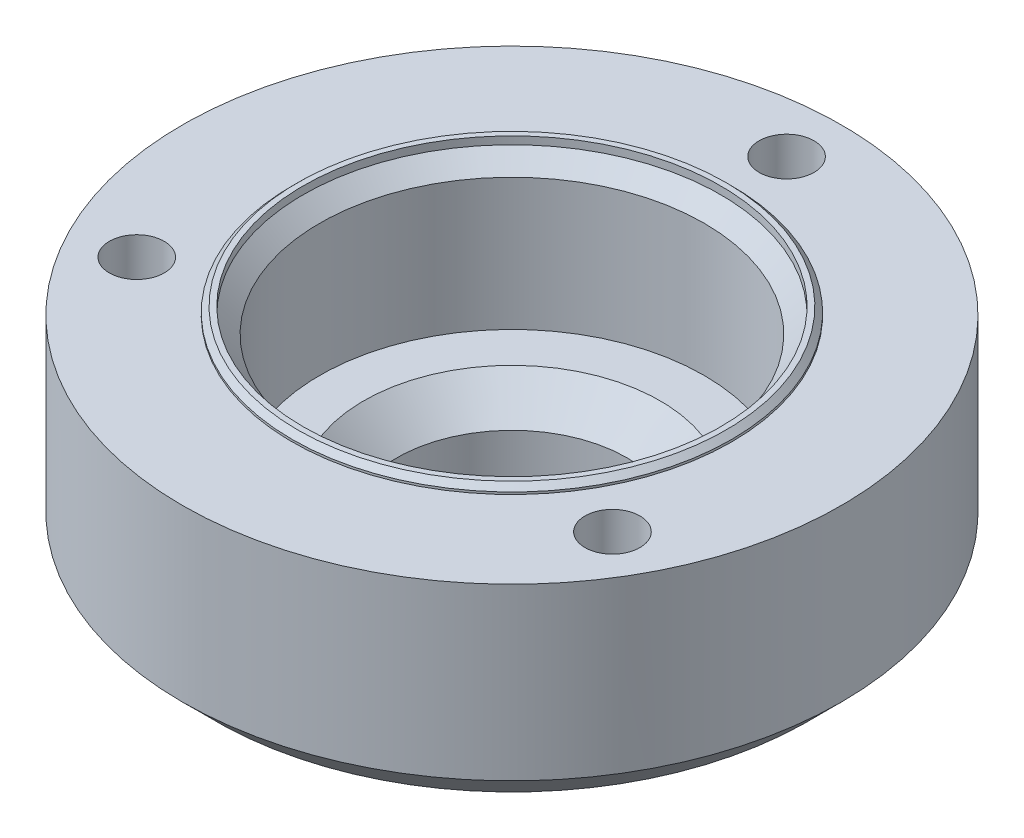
SolidWorks part; units mm, degrees
ref_plane "Face" through (0, 0, 0) normal (0, 0, 1) x (1, 0, 0)
ref_plane "Dessus" through (0, 0, 0) normal (0, 1, 0) x (1, 0, 0)
ref_plane "Droite" through (0, 0, 0) normal (1, 0, 0) x (0, 0, -1)
sketch "Esquisse1" plane through (0, 0, 0) normal (0, 0, 1) x (1, 0, 0)
  line L0 (0, 0) -> (0, 74.2586) construction
  line L1 (17.5, 54.8796) -> (17.5, 39.8796)
  line L2 (17.5, 39.8796) -> (10.5, 39.8796)
  line L3 (10.5, 39.8796) -> (10.5, 24.8796)
  dimension "D1" = 15
  dimension "D2" = 21
  dimension "D3" = 35
  dimension "D4" = 15
revolve "Révol.-Mince1" add sketch "Esquisse1" angle 360 about L0
sketch "Esquisse2" plane through (0, 54.8796, 0) normal (0, 1, 0) x (1, 0, 0)
  circle A0 centre (0, 0) radius 30
  circle A1 centre (0, 0) radius 17.5
  dimension "D1" = 60
extrude "Extrusion1" add sketch "Esquisse2" against normal up to surface (16.5 mm away) from offset 1.5
sketch "Esquisse3" plane through (0, 53.3796, 0) normal (0, 1, 0) x (1, 0, 0)
  line L0 (0, 0) -> (0, 25) construction
  line L1 (0, 0) -> (21.6506, -12.5) construction
  line L2 (0, 0) -> (-21.6506, -12.5) construction
  circle A0 centre (0, 0) radius 25 construction
  dimension "D3" = 50
  dimension "D1" = 120
  dimension "D2" = 120
hole_wizard "Trou taraudé M6x1.01" positions "Esquisse3D1" profile "Esquisse4" tap size "M6x1.0" standard "Ansi Métrique"
sketch3d "Esquisse3D1"
  point P0 (-21.6506, 53.3796, 12.5)
  point P3 (0, 53.3796, -25)
  point P6 (21.6506, 53.3796, 12.5)
sketch "Esquisse4" plane through (-21.6506, 53.3796, 12.5) normal (1, 0, 0) x (0, 0, 1)
  line L0 (0, 0) -> (0, 15.5022)
  line L1 (0, 15.5022) -> (2.5, 14)
  line L2 (2.5, 14) -> (2.5, 0)
  line L5 (2.5, 0) -> (0, 0)
  line L10 (0, 15.5022) -> (-2.5, 14) construction
  line L11 (0, -6.35) -> (0, 107.95) construction
  dimension "Diamètre du trou pour taraudage" = 5
  dimension "Profondeur du trou pour taraudage" = 14
  dimension "Angle de pointe" = 118
sketch "Esquisse5" plane through (0, 24.8796, 0) normal (0, -1, 0) x (1, 0, 0)
  circle A0 centre (0, 0) radius 12.75
  dimension "D1" = 25.5
extrude "Extrusion2" cut sketch "Esquisse5" against normal up to surface (12 mm away) flip side to cut
chamfer "Chanfrein1" distance 1 angle 45 2 edges at (0, 54.8796, -20.5) (0, 24.8796, -12.75)
sketch "Esquisse6" plane through (0, 53.3796, 0) normal (0, 1, 0) x (1, 0, 0)
  line L1 (-39.2588, 25.9409) -> (30.11, 25.9409)
  line L2 (-39.2588, 25.9409) -> (-39.2588, -23.2774)
  line L3 (-39.2588, -23.2774) -> (30.11, -23.2774)
  line L4 (30.11, 25.9409) -> (30.11, -23.2774)
extrude "Extrusion3" cut sketch "Esquisse6" along normal blind 8.4
chamfer "Chanfrein4" distance 1.5 angle 45 1 edges at (0, 53.3796, 17.5)
sketch "Esquisse7" plane through (0, 36.8796, 0) normal (0, -1, 0) x (1, 0, 0)
  circle A0 centre (0, 0) radius 20
  circle A1 centre (0, 0) radius 11.9927
  dimension "D1" = 40
extrude "Extrusion4" add sketch "Esquisse7" along normal blind 6
sketch "Esquisse10" plane through (0, 36.8796, 0) normal (0, -1, 0) x (1, 0, 0)
  circle A0 centre (0, 0) radius 30
  circle A1 centre (0, 0) radius 17.6221
extrude "Extrusion7" add sketch "Esquisse10" along normal blind 2
chamfer "Chanfrein5" distance 3 angle 45 3 edges at (0, 30.8796, -20) (0, 34.8796, -30) (0, 39.8796, -10.5)
sketch "Esquisse9" plane through (0, 24.8796, 0) normal (0, -1, 0) x (1, 0, 0)
  circle A0 centre (0, 0) radius 11.5
  dimension "D1" = 23
sketch "Esquisse11" plane through (0, 34.8796, 0) normal (0, -1, 0) x (1, 0, 0)
  circle A0 centre (0, 0) radius 12.75 construction
  circle A1 centre (0, 0) radius 12.75
  circle A2 centre (0, 0) radius 20 construction
  circle A3 centre (0, 0) radius 20
extrude "Extrusion8" cut sketch "Esquisse11" along normal blind 10
sketch "Esquisse12" plane through (0, 53.3796, 0) normal (0, 1, 0) x (1, 0, 0)
  circle A0 centre (0, 0) radius 19 construction
  circle A1 centre (0, 0) radius 19
extrude "Extru.-Mince1" add sketch "Esquisse12" along normal blind 0.7 thin
chamfer "Chanfrein6" distance 0.5 angle 45 1 edges at (20, 54.0796, 0)
